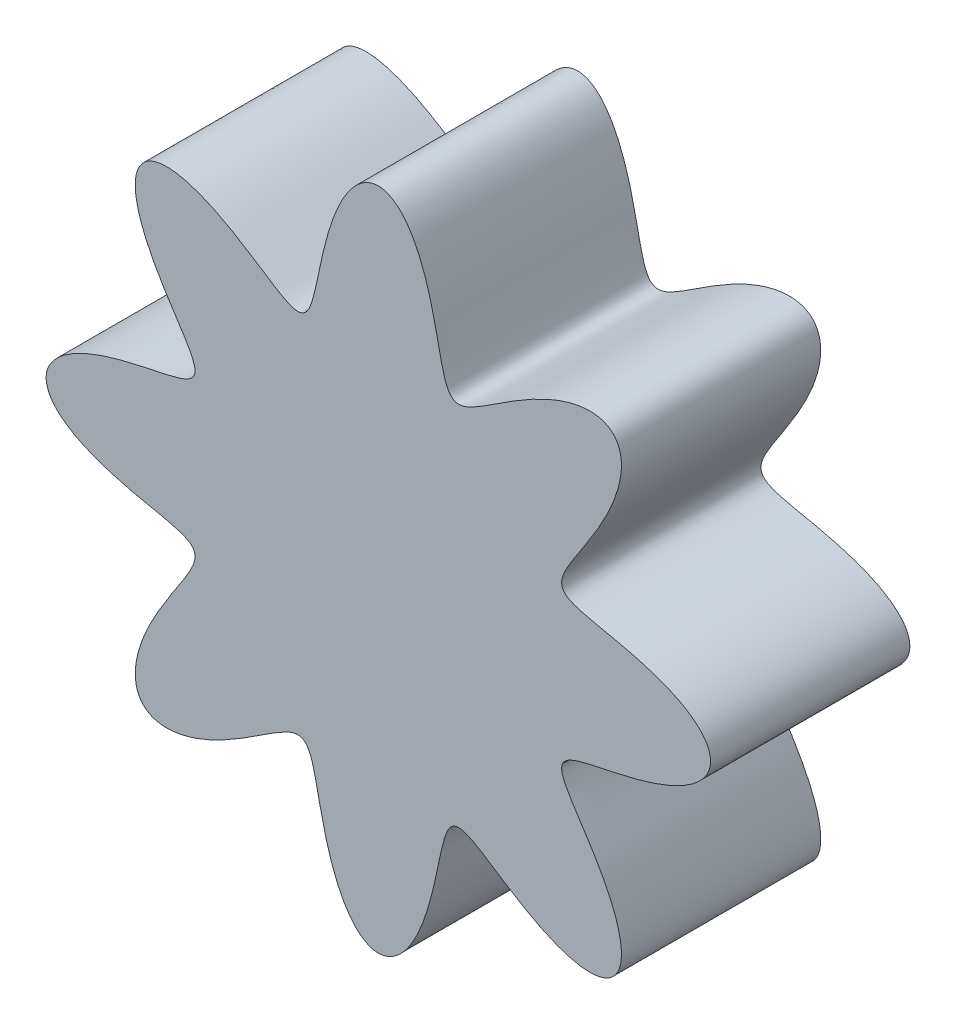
SolidWorks part; units mm, degrees
ref_plane "Front Plane" through (0, 0, 0) normal (0, 0, 1) x (1, 0, 0)
ref_plane "Top Plane" through (0, 0, 0) normal (0, 1, 0) x (1, 0, 0)
ref_plane "Right Plane" through (0, 0, 0) normal (1, 0, 0) x (0, 0, -1)
curve "Curve2"
sketch "Sketch1" plane through (0, 0, 0) normal (0, 0, 1) x (1, 0, 0)
  circle A0 centre (0, 0) radius 101.6
  circle A1 centre (0, 0) radius 127
  circle A2 centre (0, 0) radius 76.2015
  spline S0 degree 3 number of poles 363 (127, 0) -> (127, 0) construction
  dimension "D1" = 203.2
  dimension "D2" = 254
  dimension "D3" = 152.403
sketch "Sketch2" plane through (0, 0, 0) normal (0, 0, 1) x (1, 0, 0)
  spline S0 degree 3 number of poles 363 (127, 0) -> (127, 0) construction
  spline S1 degree 3 number of poles 363 (127, 0) -> (127, 0)
extrude "Boss-Extrude1" add sketch "Sketch2" along normal mid plane 76.2
